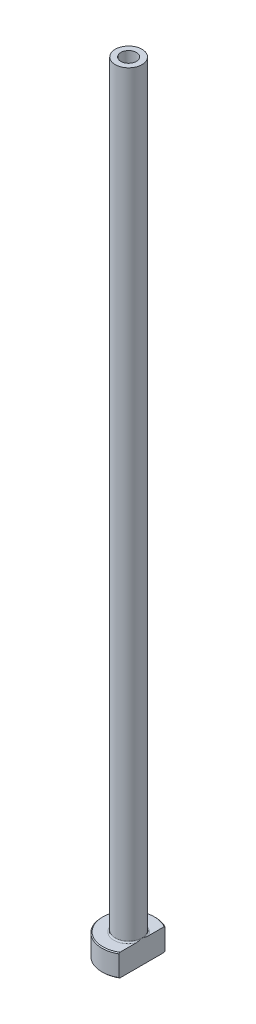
SolidWorks part; units mm, degrees
ref_plane "Front Plane" through (0, 0, 0) normal (0, 0, 1) x (1, 0, 0)
ref_plane "Top Plane" through (0, 0, 0) normal (0, 1, 0) x (1, 0, 0)
ref_plane "Right Plane" through (0, 0, 0) normal (1, 0, 0) x (0, 0, -1)
sketch "Sketch1" plane through (0, 0, 0) normal (0, 0, 1) x (1, 0, 0)
  line L0 (-1.75, 175) -> (-3, 175)
  line L1 (-3, 175) -> (-3, 5)
  line L2 (-3, 5) -> (-6, 5)
  line L3 (-6, 5) -> (-6, 0)
  line L4 (4.95, 0) -> (-4.95, 0) construction
  line L5 (-6, 0) -> (-2, 0)
  line L6 (-1.75, 130) -> (-1.75, 175)
  line L7 (0, 92.1877) -> (0, -15.5353) construction
  line L8 (0, -6.6) -> (0, 6.6) construction
  line L9 (-1.75, 130) -> (-2, 118)
  line L10 (-2, 118) -> (-2, 0)
  dimension "D1" = 0.25
  dimension "ID" = 3.5
  dimension "OD" = 6
  dimension "L" = 175
  dimension "H" = 12
  dimension "T" = 5
  dimension "N" = 45
  dimension "D2" = 12
  dimension "L-N" = 130
revolve "Revolve1" add sketch "Sketch1" angle 360 about L7
fillet "Fillet1" radius 0.3 1 edges at (0, 5, 3)
chamfer "Chamfer1" distance 0.2 angle 45 2 edges at (0, 5, 6) (0, 0, 6)
sketch "Sketch2" plane through (0, 0, 0) normal (0, -1, 0) x (1, 0, 0)
  line L0 (3, 5.1962) -> (3, -5.1962)
  circle A0 centre (0, 0) radius 6 construction
  arc A1 (3, 5.1962) -> (3, -5.1962) centre (0, 0) cw
  circle A2 centre (0, 0) radius 3 construction
extrude "Cut-Extrude1" cut sketch "Sketch2" against normal through all
chamfer "Chamfer2" distance 0.5 angle 45 1 edges at (0, 0, 2)
